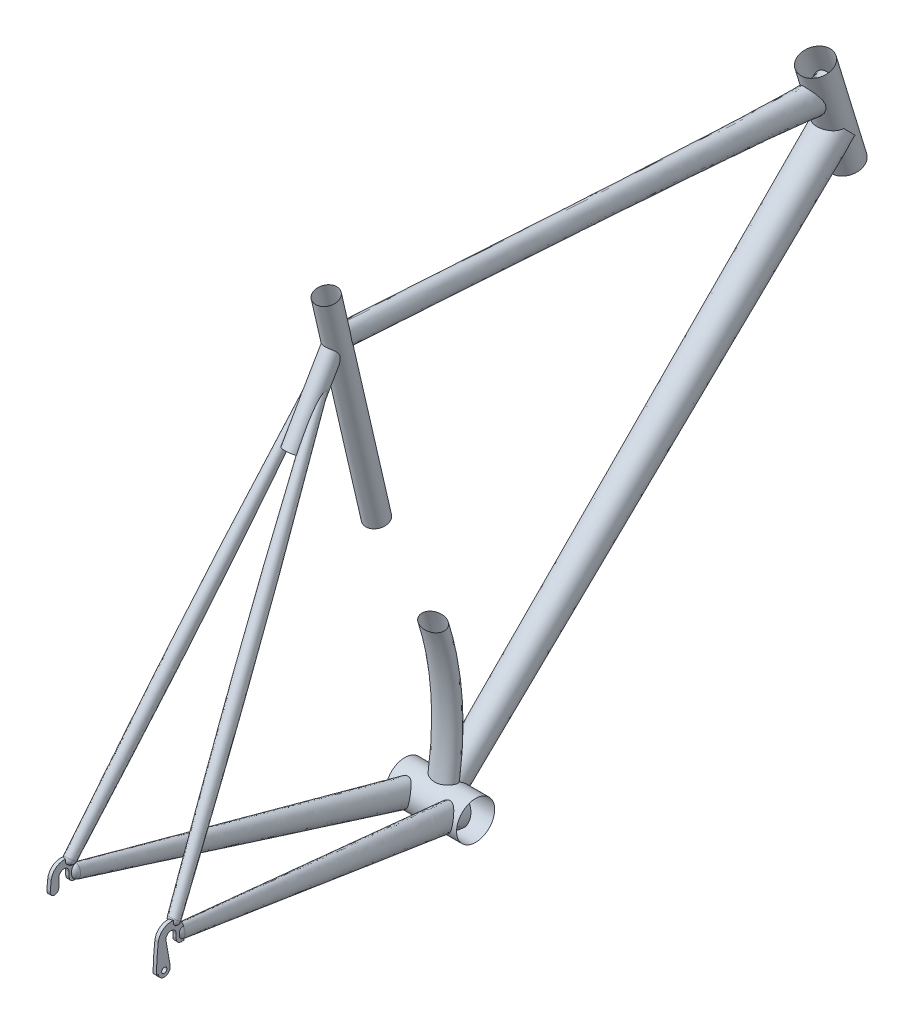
SolidWorks part; units mm, degrees
other "Top Tube"
other "Bottom Bracket"
other "Seat Tube, Lower "
other "Seat Tube, Upper "
other "Down Tube"
other "Head Tube"
other "Dropout, Left"
other "Dropout, Right"
other "Chain Stay, Right"
other "Chain Stay, Left"
other "Seat Stay, Right"
other "Seat Stay, Left"
ref_plane "Front Plane" through (0, 0, 0) normal (0, 0, 1) x (1, 0, 0)
ref_plane "Top Plane" through (0, 0, 0) normal (0, 1, 0) x (1, 0, 0)
ref_plane "Right Plane" through (0, 0, 0) normal (1, 0, 0) x (0, 0, -1)
sketch "Tube Centerlines" plane through (0, 0, 0) normal (1, 0, 0) x (0, 0, -1)
  line L0 (378.0551, 266.7) -> (837.7165, 719.7458)
  line L1 (378.0551, 266.7) -> (435.3368, 463.7667) construction
  line L2 (851.0837, 676.0236) -> (815.4378, 792.6162)
  line L3 (378.0551, 266.7) -> (0, 350)
  line L4 (0, 350) -> (256.6378, 792.6162)
  line L5 (256.6378, 792.6162) -> (826.5771, 756.181)
  line L6 (256.6378, 792.6162) -> (378.0551, 266.7) construction
  line L7 (0, 55) -> (0, -55) construction
  dimension "D1" = 45.72
  dimension "D2" = 38.1
  dimension "D3" = 38.1
  dimension "D4" = 72.32
  dimension "D5" = 116.448
  dimension "D6" = 122.989
  dimension "D7" = 539.75
  dimension "D8" = 17
imported_body "Tube Cap 1"
imported_body "Tube Cap 2"
imported_body "Tube Cap 3"
imported_body "Tube Cap 4"
imported_body "Chain Stay, Left"
imported_body "Seat Stay, Left"
imported_body "Chain Stay, Right"
imported_body "Seat Stay, Right"
imported_body "Seat Stay, Center"
imported_body "Top Tube"
imported_body "Bottom Bracket"
imported_body "Seat Tube, Lower"
imported_body "Seat Tube, Upper"
imported_body "Down Tube"
imported_body "Head Tube"
imported_body "Dropout, Right"
imported_body "Dropout, Left"
surface "Chain Stay, Right Knit"
surface "Chain Stay, Left Knit"
surface "Seat Stay, Right Knit"
surface "Seat Stay, Left Knit"
ref_plane "Plane1" through (0, 368.5924, -107.1393) normal (0, 0.9603, -0.2791) x (1, 0, 0)
sketch "Upper Seat Tube Blend" plane through (0, 0, 0) normal (1, 0, 0) x (0, 0, -1)
  line L0 (269.5687, 821.0693) -> (283.2907, 761.6327) construction
  line L1 (303.7763, 588.437) -> (245.2103, 842.1142) construction
  line L2 (285.8531, 812.7692) -> (294.2886, 776.2314)
  line L4 (256.6378, 792.6162) -> (826.5771, 756.181) construction
  line L5 (256.6378, 792.6162) -> (378.0551, 266.7) construction
  line L6 (259.1346, 787.3581) -> (293.7247, 795.3439) construction
  ellipse E0 centre (276.4297, 791.351) end of major axis (269.5687, 821.0693) minor radius 17.75 (285.8531, 812.7692) -> (294.2886, 776.2314) ccw
  dimension "D1" = 61
  dimension "D2" = 35.5
  dimension "D3" = 19
  dimension "D4" = 33
sketch "Head Tube Blend" plane through (0, 0, 0) normal (1, 0, 0) x (0, 0, -1)
  arc A0 (782.7914, 778.2013) -> (785.9539, 768.5651) centre (627.0633, 721.7563) cw
  arc A1 (796.4719, 717.05) -> (803.6708, 702.9583) centre (634.0743, 625.2026) cw
  arc A2 (785.9539, 768.5651) -> (790.675, 747.6116) centre (627.0633, 721.7563) cw
  arc A3 (790.675, 747.6116) -> (792.0611, 736.3508) centre (627.0633, 721.7563) cw
  arc A4 (803.6708, 702.9583) -> (813.5251, 676.2549) centre (634.0743, 625.2026) cw
  arc A5 (813.5251, 676.2549) -> (816.3144, 665.1709) centre (634.0743, 625.2026) cw
  spline S0 degree 3 poles (791.0459, 779.6038) (795.7312, 780.3476) (800.4165, 781.0915) (804.099, 781.4265) knots 0 0 0 0 0.078134 0.078134 0.078134 0.078134
  spline S1 degree 3 poles (835.129, 674.9911) (832.3021, 673.2012) (824.3083, 669.186) (816.3144, 665.1709) knots 0.926015 0.926015 0.926015 0.926015 1 1 1 1
  spline S2 degree 3 poles (804.099, 781.4265) (810.9979, 782.0541) (819.3231, 775.748) (833.5498, 733.4658) (841.4995, 708.3482) (842.9574, 680.3232) (837.172, 676.2847) (835.129, 674.9911) knots 0.078134 0.078134 0.078134 0.078134 0.166979 0.457547 0.746011 0.872546 0.926015 0.926015 0.926015 0.926015
sketch "Lower Seat Tube Blend" plane through (0, 0, 0) normal (1, 0, 0) x (0, 0, -1)
  line L0 (399.2769, 319.0604) -> (406.245, 311.9906)
  line L1 (353.8646, 319.0555) -> (379.1969, 317.6256)
  line L3 (406.245, 311.9906) -> (422.9164, 295.0757)
  line L4 (422.9164, 295.0757) -> (430.2528, 287.6322)
  line L5 (393.6721, 316.8086) -> (398.9212, 316.5123)
  line L6 (379.1969, 317.6256) -> (393.6721, 316.8086)
  line L7 (378.0551, 266.7) -> (837.7165, 719.7458) construction
sketch "Bottom Bracket Blend" plane through (0, -383.8478, -2695.7663) normal (0, -0.9603, 0.2791) x (1, 0, 0)
  line L2 (0, 2438.9275) -> (0, 2375.4275) construction
  line L3 (0, 2365.4934) -> (0, 3026.0392) construction
  line L5 (-25, 2407.1775) -> (25, 2407.1775) construction
  ellipse E0 centre (0, 2407.1775) end of major axis (0, 2375.4275) minor radius 25 (-17.282, 2430.1197) -> (-17.282, 2384.2354) ccw
  ellipse E1 centre (0, 2407.1775) end of major axis (0, 2438.9275) minor radius 25 (17.282, 2430.1197) -> (-17.282, 2430.1197) ccw
  ellipse E2 centre (0, 2407.1775) end of major axis (0, 2438.9275) minor radius 25 (-17.282, 2384.2354) -> (17.282, 2384.2354) ccw
  ellipse E3 centre (0, 2407.1775) end of major axis (0, 2438.9275) minor radius 25 (17.282, 2384.2354) -> (17.282, 2430.1197) ccw
  dimension "D1" = 50
  dimension "D2" = 63.5
